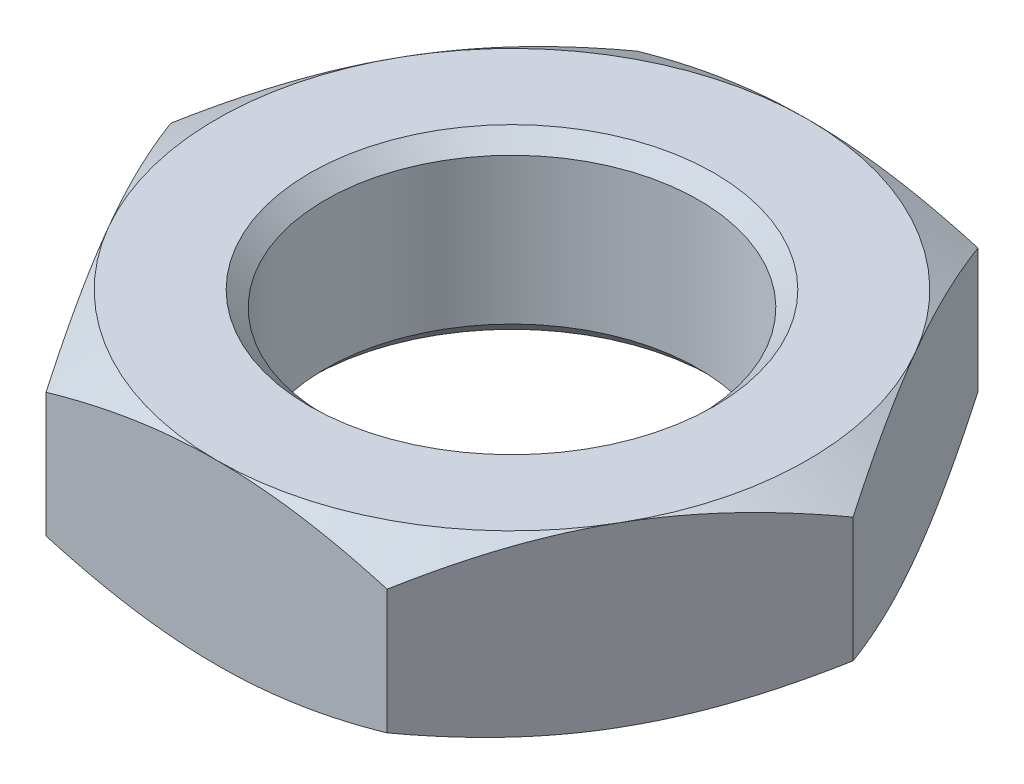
SolidWorks part; units mm, degrees
ref_plane "Front Plane" through (0, 0, 0) normal (0, 0, 1) x (1, 0, 0)
ref_plane "Top Plane" through (0, 0, 0) normal (0, 1, 0) x (1, 0, 0)
ref_plane "Right Plane" through (0, 0, 0) normal (1, 0, 0) x (0, 0, -1)
sketch "Sketch1" plane through (0, 0, 0) normal (0, 1, 0) x (1, 0, 0)
  line L1 (5.4848, 9.5) -> (-5.4848, 9.5)
  line L2 (-5.4848, 9.5) -> (-10.9697, 0)
  line L3 (-10.9697, 0) -> (-5.4848, -9.5)
  line L4 (-5.4848, -9.5) -> (5.4848, -9.5)
  line L5 (5.4848, -9.5) -> (10.9697, 0)
  line L6 (10.9697, 0) -> (5.4848, 9.5)
  circle A0 centre (0, 0) radius 9.5 construction
  circle A1 centre (0, 0) radius 6
  dimension "D1" = 12
  dimension "D2" = 19
extrude "Boss-Extrude1" add sketch "Sketch1" along normal mid plane 5.7
sketch "Sketch2" plane through (0, 0, 0) normal (1, 0, 0) x (0, 0, -1)
  line L0 (9.5, 2.85) -> (17.7272, 2.85)
  line L1 (17.7272, 2.85) -> (17.7272, -1.9)
  line L2 (17.7272, -1.9) -> (9.5, 2.85)
  line L3 (9.5, 2.85) -> (0, 2.85) construction
  line L4 (-9.5, -2.85) -> (-17.7272, -2.85)
  line L5 (-17.7272, -2.85) -> (-17.7272, 1.9)
  line L6 (-17.7272, 1.9) -> (-9.5, -2.85)
  dimension "D1" = 30
revolve "Cut-Revolve1" cut sketch "Sketch2" angle 360 about axis through (0, 2.85, 0) along (0, -1, 0)
chamfer "Chamfer1" distance 0.5 angle 45 2 edges at (0, -2.85, 6) (0, 2.85, 6)
